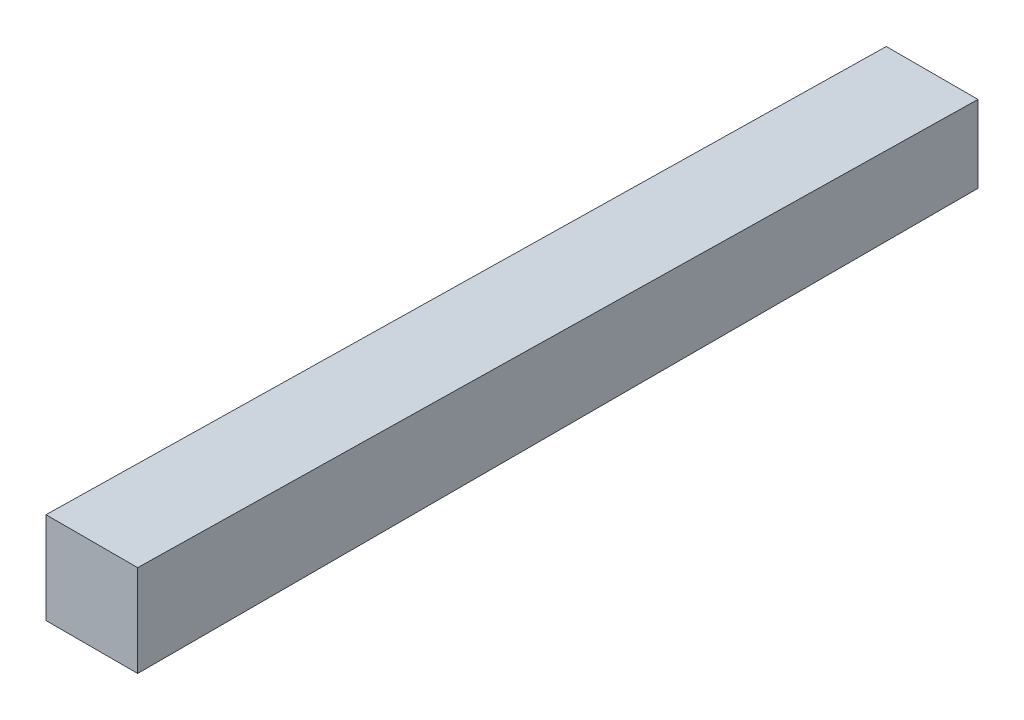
SolidWorks part; units mm, degrees
ref_plane "Front Plane" through (0, 0, 0) normal (0, 0, 1) x (1, 0, 0)
ref_plane "Top Plane" through (0, 0, 0) normal (0, 1, 0) x (1, 0, 0)
ref_plane "Right Plane" through (0, 0, 0) normal (1, 0, 0) x (0, 0, -1)
sketch "Sketch1" plane through (0, 0, 0) normal (0, 0, 1) x (1, 0, 0)
  line L2 (-3, -3) -> (3, -3)
  line L3 (-3, -3) -> (-3, 3)
  line L4 (-3, 3) -> (3, 3)
  line L5 (3, -3) -> (3, 3)
  line L6 (-3, -3) -> (3, 3) construction
  line L7 (-3, 3) -> (3, -3) construction
  point P0 (0, 0)
  dimension "D1" = 6
  dimension "D2" = 6
extrude "Boss-Extrude1" add sketch "Sketch1" along normal blind 55
draft "Draft1" type of draft neutral plane draft angle 1 faces to draft 1 parameters "D1"=1
